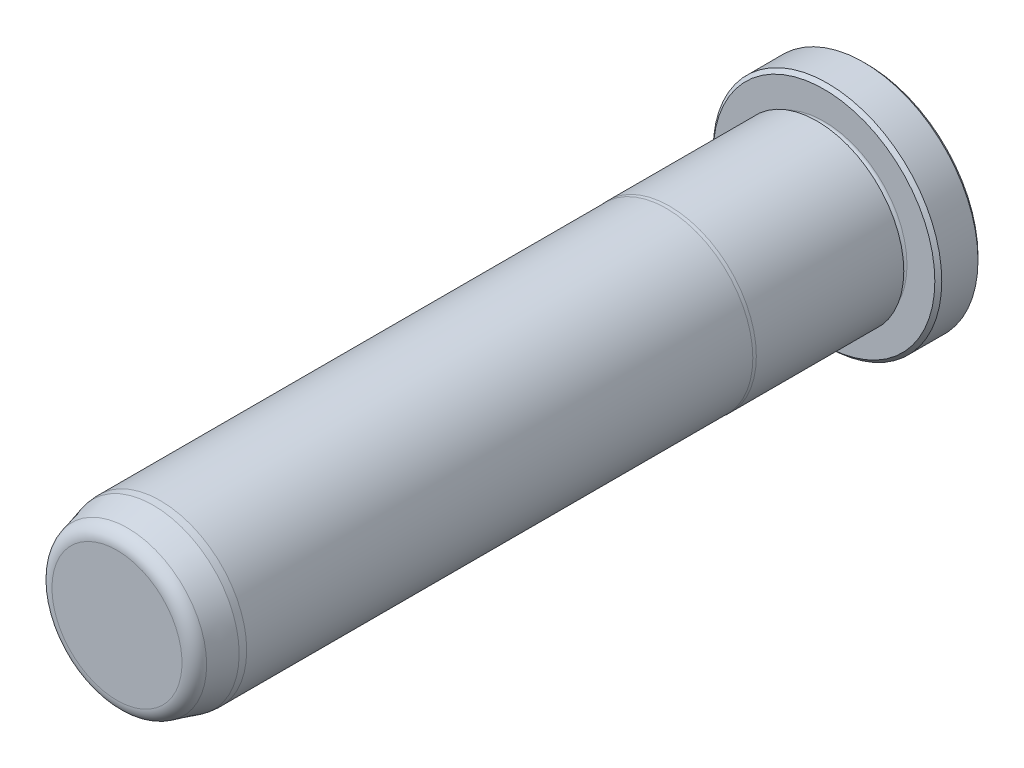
SolidWorks part; units mm, degrees
ref_plane "Front Plane" through (0, 0, 0) normal (0, 0, 1) x (1, 0, 0)
ref_plane "Top Plane" through (0, 0, 0) normal (0, 1, 0) x (1, 0, 0)
ref_plane "Right Plane" through (0, 0, 0) normal (1, 0, 0) x (0, 0, -1)
sketch "Sketch1" plane through (0, 0, 0) normal (1, 0, 0) x (0, 0, -1)
  line L0 (0, 0) -> (0, 12.573)
  line L1 (0, 12.573) -> (-4.7498, 12.573)
  line L2 (-4.7498, 12.573) -> (-4.7498, 9.1313)
  line L3 (-4.7498, 8.7503) -> (-5.5118, 8.7503) construction
  line L4 (-5.5118, 9.1313) -> (-5.5118, 9.5377)
  line L5 (-5.5118, 9.5377) -> (-21.7348, 9.5377)
  line L6 (-21.7348, 9.5377) -> (-22.098, 9.5123)
  line L7 (-22.098, 9.5123) -> (-77.7875, 9.5123)
  line L9 (-82.55, 8.3737) -> (-82.55, 0)
  line L10 (-82.55, 0) -> (0, 0)
  line L11 (0, 0) -> (13.6287, 0) construction
  line L12 (-77.7875, 9.5123) -> (-78.5495, 9.4456)
  line L13 (-78.5495, 9.4456) -> (-82.55, 8.3737)
  arc A0 (-5.5118, 9.1313) -> (-4.7498, 9.1313) centre (-5.1308, 9.1313) ccw
  dimension "D14" = 0.762
  dimension "D1" = 4.7498
  dimension "D2" = 0.762
  dimension "D3" = 25.146
  dimension "D4" = 19.0754
  dimension "D5" = 22.098
  dimension "D6" = 82.55
  dimension "D7" = 0.7874
  dimension "D8" = 4
  dimension "D9" = 19.0246
  dimension "D10" = 5
  dimension "D11" = 15
  dimension "D12" = 0.762
  dimension "D13" = 4.7625
revolve "Revolve1" add sketch "Sketch1" angle 360 about L11
fillet "Fillet6" radius 1.5875 1 edges at (8.3737, 0, 82.55)
chamfer "Chamfer1" distance 0.381 angle 45 2 edges at (12.573, 0, 0) (12.573, 0, 4.7498)
